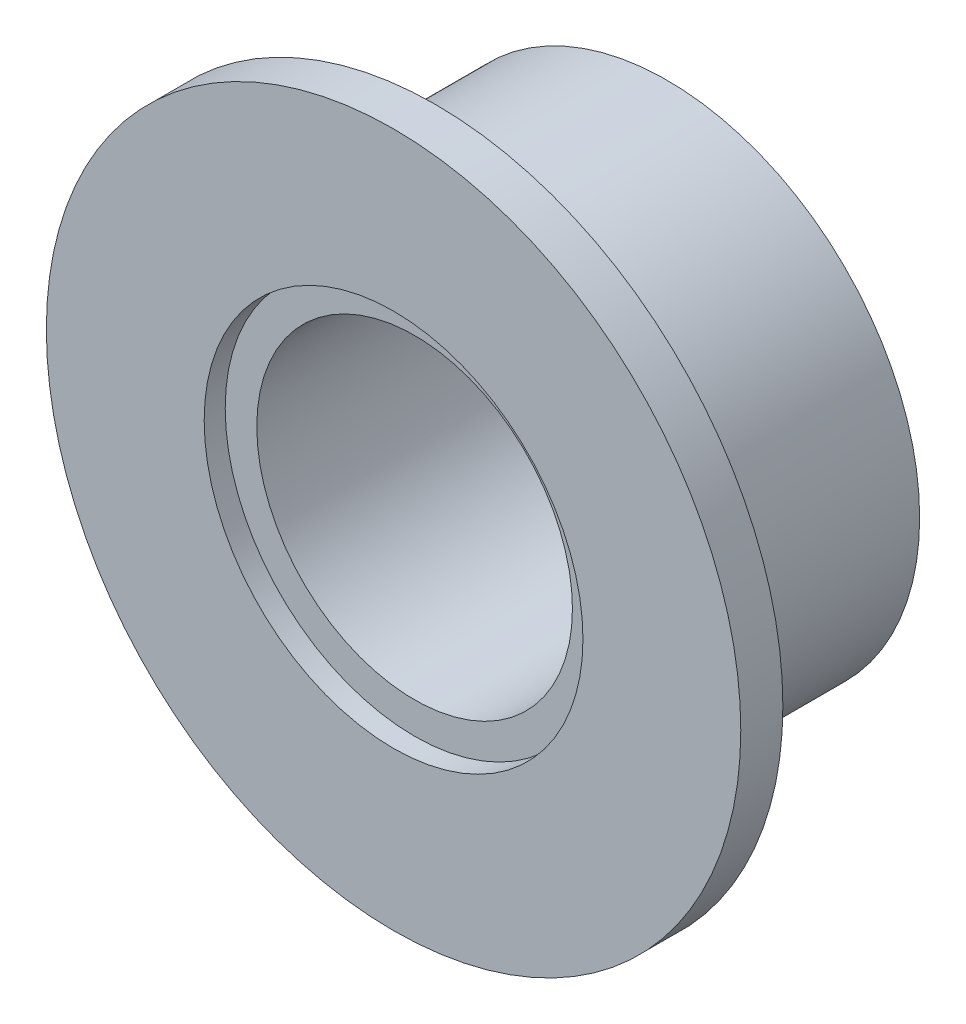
SolidWorks part; units mm, degrees
ref_plane "Ön Düzlem" through (0, 0, 0) normal (0, 0, 1) x (1, 0, 0)
ref_plane "Üst Düzlem" through (0, 0, 0) normal (0, 1, 0) x (1, 0, 0)
ref_plane "Sağ Düzlem" through (0, 0, 0) normal (1, 0, 0) x (0, 0, -1)
sketch "Sketch2" plane through (0, 0, 0) normal (0, 0, 1) x (1, 0, 0)
  circle A0 centre (0, 0) radius 12
  dimension "D1" = 24
extrude "Boss-Extrude2" add sketch "Sketch2" along normal blind 11
sketch "Sketch3" plane through (0, 0, 11) normal (0, 0, 1) x (1, 0, 0)
  circle A3 centre (0, 0) radius 16.5
  dimension "D1" = 33
extrude "Boss-Extrude3" add sketch "Sketch3" along normal blind 2
hole_wizard "Hole1" positions "Sketch7" profile "Sketch8" legacy
sketch "Sketch7" plane through (0, 0, 13) normal (0, 0, 1) x (1, 0, 0)
  point P0 (0, 0)
sketch "Sketch8" plane through (0, 0, 13) normal (1, 0, 0) x (0, -1, 0)
  line L0 (0, 0) -> (0, 12999.9999)
  line L1 (0, 12999.9999) -> (7.5, 12999.9999)
  line L2 (7.5, 12999.9999) -> (7.5, 1)
  line L3 (7.5, 1) -> (9, 1)
  line L4 (9, 1) -> (9, 0)
  line L5 (9, 0) -> (0, 0)
  line L6 (0, 110) -> (0, -10) construction
  dimension "Diameter" = 15
  dimension "Depth" = 13000
  dimension "C-Bore Diameter" = 18
  dimension "C-Bore Depth" = 1
